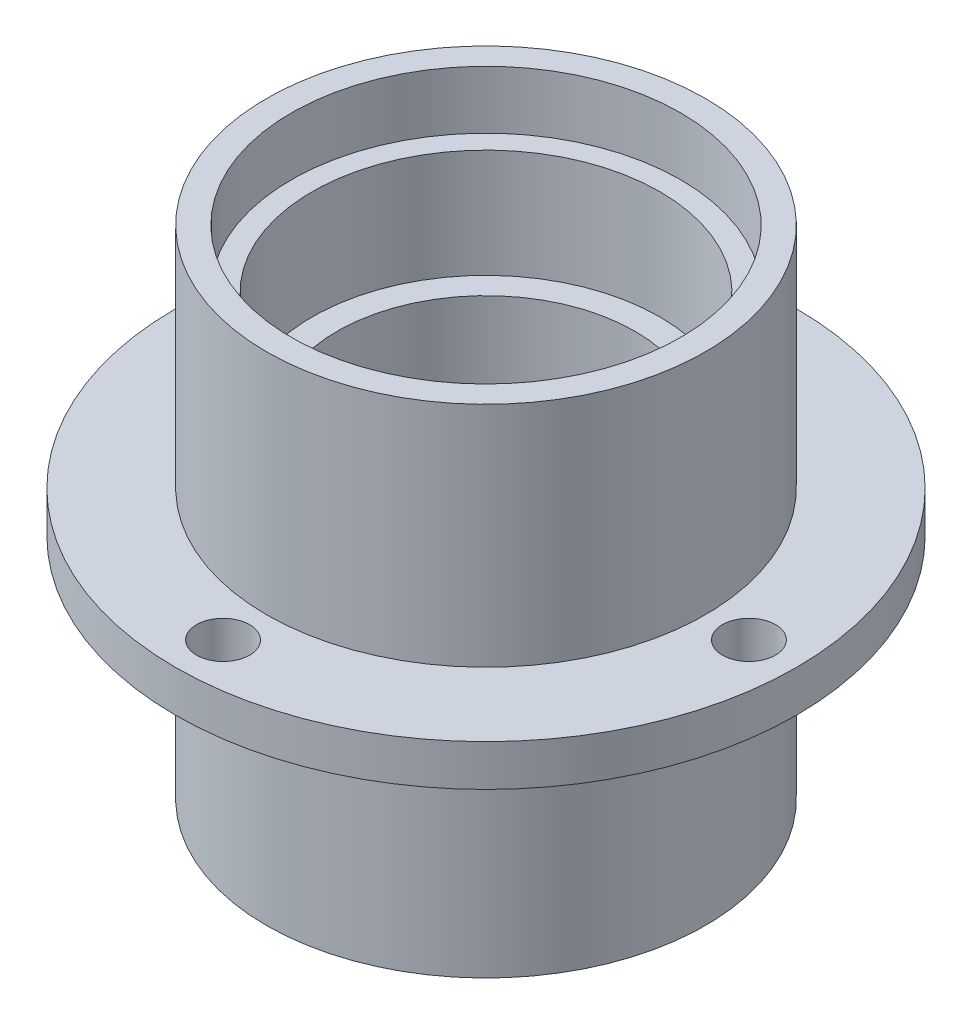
SolidWorks part; units mm, degrees
ref_plane "Plan de face" through (0, 0, 0) normal (0, 0, 1) x (1, 0, 0)
ref_plane "Plan de dessus" through (0, 0, 0) normal (0, 1, 0) x (1, 0, 0)
ref_plane "Plan de droite" through (0, 0, 0) normal (1, 0, 0) x (0, 0, -1)
sketch "Esquisse1" plane through (0, 0, 0) normal (1, 0, 0) x (0, 0, -1)
  line L0 (0, -13.2148) -> (0, 69.6098) construction
  line L1 (23.5, 60.1) -> (23.5, 53.1)
  line L2 (23.5, 53.1) -> (21, 53.1)
  line L3 (21, 53.1) -> (21, 40)
  line L4 (23.5, 0) -> (26.5, 0.1)
  line L5 (26.5, 0.1) -> (26.5, 27.6)
  line L6 (26.5, 27.6) -> (37.5, 27.6)
  line L7 (37.5, 27.6) -> (37.5, 32.6)
  line L8 (37.5, 32.6) -> (26.5, 32.6)
  line L9 (26.5, 32.6) -> (26.5, 60.1)
  line L10 (26.5, 60.1) -> (23.5, 60.1)
  line L11 (21, 40) -> (18, 40)
  line L12 (18, 40) -> (18, 20)
  line L13 (18, 20) -> (21, 20)
  line L14 (21, 20) -> (21, 7)
  line L15 (21, 7) -> (23.5, 7)
  line L16 (23.5, 7) -> (23.5, 0)
  dimension "D1" = 3
  dimension "D2" = 2.5
  dimension "D3" = 7
  dimension "D4" = 27.5
  dimension "D5" = 11
  dimension "D6" = 11
  dimension "D7" = 5
  dimension "D8" = 18
  dimension "D9" = 13.1
  dimension "D10" = 3
  dimension "D11" = 27.5
  dimension "D12" = 3
  dimension "D13" = 13
  dimension "D14" = 2.5
  dimension "D15" = 7
  dimension "D16" = 20
revolve "Révolution1" add sketch "Esquisse1" angle 360 about L0
sketch "Esquisse2" plane through (0, 32.6, 0) normal (0, 1, 0) x (-1, 0, 0)
  line L1 (41.6103, 0) -> (-105.1103, 0) construction
  circle A0 centre (-31.75, 0) radius 3.2
  circle A1 centre (0, 31.75) radius 3.2
  circle A2 centre (31.75, 0) radius 3.2
  circle A3 centre (0, -31.75) radius 3.2
  dimension "D1" = 31.75
  dimension "D2" = 6.4
extrude "Extrusion1" cut sketch "Esquisse2" against normal blind 10
